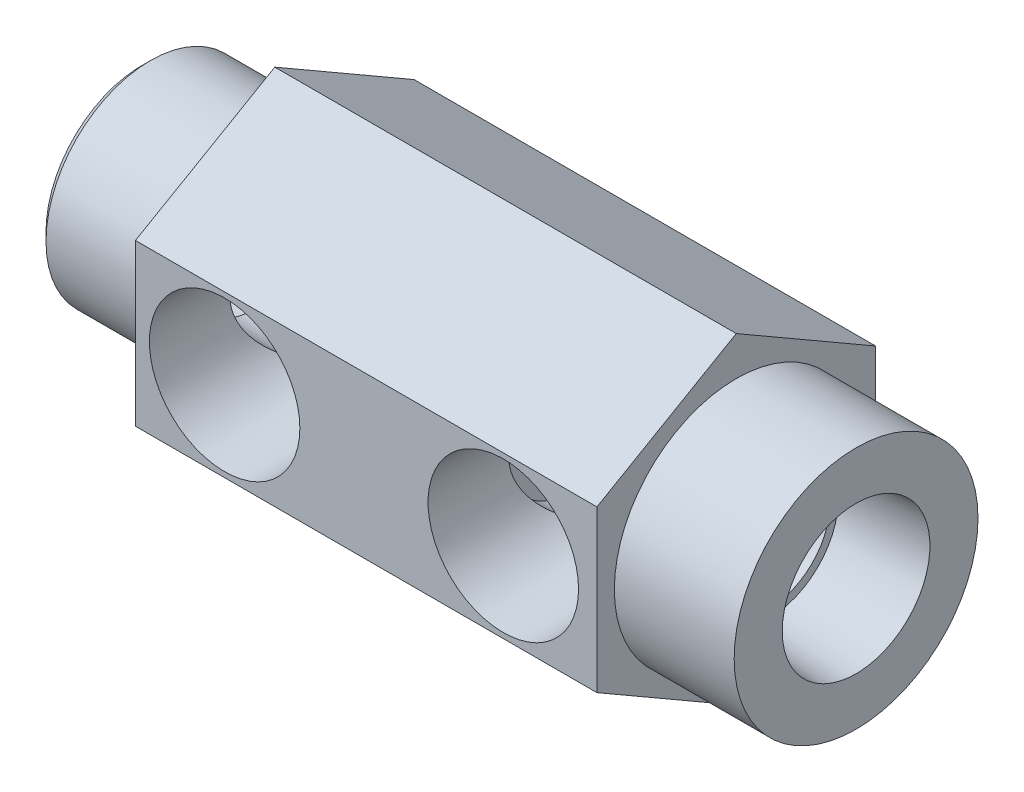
SolidWorks part; units mm, degrees
ref_plane "Front Plane" through (0, 0, 0) normal (0, 0, 1) x (1, 0, 0)
ref_plane "Top Plane" through (0, 0, 0) normal (0, 1, 0) x (1, 0, 0)
ref_plane "Right Plane" through (0, 0, 0) normal (1, 0, 0) x (0, 0, -1)
sketch "Sketch1" plane through (0, 0, 0) normal (1, 0, 0) x (0, 0, -1)
  line L0 (0, 16.1312) -> (0, -16.1312) construction
  line L1 (-12.7, -7.3323) -> (0, -14.6647)
  line L2 (0, -14.6647) -> (12.7, -7.3323)
  line L3 (12.7, -7.3323) -> (12.7, 7.3323)
  line L4 (12.7, 7.3323) -> (0, 14.6647)
  line L5 (0, 14.6647) -> (-12.7, 7.3323)
  line L6 (-12.7, 7.3323) -> (-12.7, -7.3323)
  circle A0 centre (0, 0) radius 12.7 construction
  dimension "D1" = 25.4
extrude "Boss-Extrude1" add sketch "Sketch1" along normal blind 42.0624 separate body
sketch "Sketch2" plane through (0, 0, 0) normal (1, 0, 0) x (0, 0, -1)
  circle A1 centre (0, 0) radius 11.1125
  dimension "D1" = 22.225
extrude "Boss-Extrude2" add sketch "Sketch2" along normal blind 52.9844
sketch "Sketch12" plane through (0, 0, 0) normal (-1, 0, 0) x (0, 0, 1)
  circle A0 centre (0, 0) radius 9.525
  dimension "D1" = 19.05
extrude "Boss-Extrude3" add sketch "Sketch12" along normal offset from surface (12.0904 mm away) 65.0748
hole_wizard "1/4 NPT Tapped Hole1" positions "Sketch8" profile "Sketch7" size "1/4" standard "Ansi Inch"
sketch "Sketch8" plane through (0, 0, 12.7) normal (0, 0, 1) x (1, 0, 0)
  line L0 (13.97, 0) -> (-13.97, 0) construction
  line L1 (0, -13.97) -> (0, 13.97) construction
  point P0 (8.128, 0)
  point P1 (33.528, 0)
  dimension "D1" = 8.128
  dimension "D2" = 25.4
sketch "Sketch7" plane through (8.128, 0, 12.7) normal (1, 0, 0) x (0, -1, 0)
  line L0 (0, 0) -> (0, 20.4111)
  line L1 (5.5626, 17.0688) -> (0, 20.4111)
  line L2 (-5.5626, 17.0688) -> (0, 20.4111) construction
  line L3 (5.5626, 17.0688) -> (5.5626, 10.0203)
  line L4 (5.5626, 10.0203) -> (6.558, 10.0203)
  line L5 (6.558, 10.0203) -> (6.858, 0)
  line L6 (-6.558, 10.0203) -> (-6.858, 0) construction
  line L7 (6.858, 0) -> (0, 0)
  line L8 (0, -6.35) -> (0, 107.95) construction
  line L11 (-5.5626, 10.0203) -> (-6.558, 10.0203) construction
  dimension "Tap Drill Dia." = 11.1252
  dimension "Tap Drill Depth" = 17.0688
  dimension "Thread Dia." = 13.716
  dimension "Thread Angle" = 3.43
  dimension "Thread Depth" = 10.0203
  dimension "Drill Angle" = 118
hole_wizard "1/4 NPT Tapped Hole2" positions "Sketch10" profile "Sketch9" size "1/4" standard "Ansi Inch"
sketch "Sketch10" plane through (0, 0, -12.7) normal (0, 0, -1) x (-1, 0, 0)
  circle A0 centre (-8.128, 0) radius 6.858 construction
  point P0 (-8.128, 0)
sketch "Sketch9" plane through (8.128, 0, -12.7) normal (1, 0, 0) x (0, 1, 0)
  line L0 (0, 0) -> (0, 20.4111)
  line L1 (5.5626, 17.0688) -> (0, 20.4111)
  line L2 (-5.5626, 17.0688) -> (0, 20.4111) construction
  line L3 (5.5626, 17.0688) -> (5.5626, 10.0203)
  line L4 (5.5626, 10.0203) -> (6.558, 10.0203)
  line L5 (6.558, 10.0203) -> (6.858, 0)
  line L6 (-6.558, 10.0203) -> (-6.858, 0) construction
  line L7 (6.858, 0) -> (0, 0)
  line L8 (0, -6.35) -> (0, 107.95) construction
  line L11 (-5.5626, 10.0203) -> (-6.558, 10.0203) construction
  dimension "Tap Drill Dia." = 11.1252
  dimension "Tap Drill Depth" = 17.0688
  dimension "Thread Dia." = 13.716
  dimension "Thread Angle" = 3.43
  dimension "Thread Depth" = 10.0203
  dimension "Drill Angle" = 118
sketch "Sketch11" plane through (0, 0, 0) normal (0, 0, 1) x (1, 0, 0)
  line L3 (52.9844, 6.731) -> (45.0596, 6.3157)
  line L4 (45.0596, 5.5499) -> (45.0596, 6.3157)
  line L5 (45.0596, 5.5499) -> (26.7906, 5.5499)
  line L6 (52.9844, -11.1125) -> (52.9844, 11.1125) construction
  line L7 (52.9844, 0) -> (52.9844, 6.731)
  line L8 (0, 0) -> (50000, 0) construction
  line L9 (0, 7.3323) -> (0, -7.3323) construction
  line L10 (26.7906, 0) -> (26.7906, 5.5499)
  line L11 (26.7906, 0) -> (52.9844, 0)
  point P11 (0, 0)
  dimension "D1" = 26.1937
  dimension "D2" = 13.462
  dimension "D3" = 11.0998
  dimension "D4" = 7.9248
  dimension "D5" = 3
revolve "Cut-Revolve1" cut sketch "Sketch11" angle 360 about L8
hole_wizard "1/4 NPT Tapped Hole3" positions "Sketch13" profile "Sketch15" size "1/4" standard "ANSI Inch"
sketch "Sketch13" plane through (-12.0904, 0, 0) normal (-1, 0, 0) x (0, 0, 1)
  point P0 (0, 0)
sketch "Sketch15" plane through (-12.0904, 0, 0) normal (0, 1, 0) x (0, 0, 1)
  line L0 (0, 0) -> (0, 28.4988)
  line L1 (5.5626, 28.4988) -> (0, 28.4988)
  line L2 (-5.5626, 28.4988) -> (0, 28.4988) construction
  line L3 (5.5626, 28.4988) -> (5.5626, 10.0203)
  line L4 (5.5626, 10.0203) -> (6.558, 10.0203)
  line L5 (6.558, 10.0203) -> (6.858, 0)
  line L6 (-6.558, 10.0203) -> (-6.858, 0) construction
  line L7 (6.858, 0) -> (0, 0)
  line L8 (0, -6.35) -> (0, 107.95) construction
  line L9 (11.1125, 65.0748) -> (-11.1125, 65.0748) construction
  line L11 (-5.5626, 10.0203) -> (-6.558, 10.0203) construction
  dimension "Tap Drill Dia." = 11.1252
  dimension "Tap Drill Depth" = 28.4988
  dimension "Thread Dia." = 13.716
  dimension "Thread Angle" = 3.43
  dimension "Thread Depth" = 10.0203
  dimension "Drill Angle" = 180
hole_wizard "1/8 NPT Tapped Hole1" positions "Sketch16" profile "Sketch18" size "1/8" standard "ANSI Inch"
sketch "Sketch16" plane through (16.4084, 0, 0) normal (-1, 0, 0) x (0, 0, 1)
  point P0 (0, 0)
sketch "Sketch18" plane through (16.4084, 0, 0) normal (0, 1, 0) x (0, 0, 1)
  line L0 (0, 0) -> (0, 36.576)
  line L1 (0, 36.576) -> (4.2164, 36.576)
  line L2 (-4.9362, 6.924) -> (-5.1435, 0) construction
  line L3 (4.2164, 36.576) -> (4.2164, 6.924)
  line L4 (4.2164, 6.924) -> (4.9362, 6.924)
  line L5 (4.9362, 6.924) -> (5.1435, 0)
  line L7 (5.1435, 0) -> (0, 0)
  line L8 (0, -6.35) -> (0, 107.95) construction
  line L11 (-4.2164, 6.924) -> (-4.9362, 6.924) construction
  dimension "Thru Tap Drill Dia." = 8.4328
  dimension "Thru Tap Drill Depth" = 36.576
  dimension "Thread Dia." = 10.287
  dimension "Thread Angle" = 3.43
  dimension "Thread Depth" = 6.924
fillet "Fillet1" radius 1.524 1 edges at (0, 0, 9.525)
chamfer "Chamfer1" distance 0.762 angle 45 1 edges at (-12.0904, 0, -9.525)
